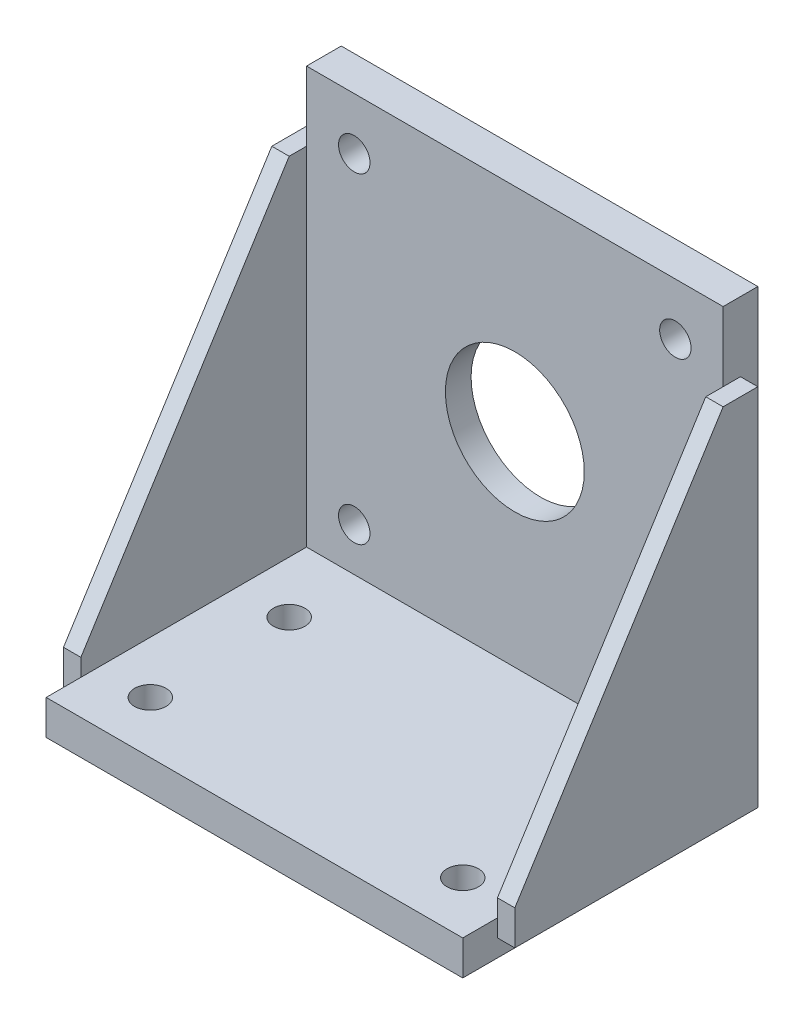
SolidWorks part; units mm, degrees
ref_plane "front" through (0, 0, 0) normal (0, 0, 1) x (1, 0, 0)
ref_plane "top" through (0, 0, 0) normal (0, 1, 0) x (1, 0, 0)
ref_plane "side" through (0, 0, 0) normal (1, 0, 0) x (0, 0, -1)
sketch "Sketch1" plane through (0, 0, 0) normal (0, 0, 1) x (1, 0, 0)
  line L0 (0, 0) -> (0, 77.7875) construction
  line L1 (-58.7375, 0) -> (0, 0) construction
  line L2 (76.2, -74.6125) -> (76.2, 77.7875)
  line L3 (76.2, 77.7875) -> (-76.2, 77.7875)
  line L4 (-76.2, 77.7875) -> (-76.2, -74.6125)
  line L5 (76.2, -74.6125) -> (-76.2, -74.6125)
  line L6 (-58.7375, 58.7375) -> (58.7375, 58.7375) construction
  line L7 (-58.7375, -58.7375) -> (58.7375, -58.7375) construction
  line L8 (-58.7375, -58.7375) -> (-58.7375, 58.7375) construction
  line L9 (58.7375, -58.7375) -> (58.7375, 58.7375) construction
  point P8 (-58.7375, 58.7375)
  point P10 (58.7375, 58.7375)
  point P11 (58.7375, -58.7375)
  dimension "D1" = 77.7875
  dimension "D3" = 117.475
  dimension "D2" = 152.4
  dimension "D5" = 19.05
  dimension "D6" = 152.4
extrude "Base-Extrude" add sketch "Sketch1" along normal blind 12.7
sketch "Sketch2" plane through (76.2, 0, 0) normal (1, 0, 0) x (0, 0, -1)
  line L0 (-6.35, -74.6125) -> (-107.95, -74.6125)
  line L1 (-6.35, -74.6125) -> (-6.35, -87.3125)
  line L2 (-107.95, -87.3125) -> (-6.35, -87.3125)
  line L3 (-107.95, -87.3125) -> (-107.95, -74.6125)
  line L4 (-12.7, -74.6125) -> (0, -74.6125) construction
  dimension "D1" = 101.6
  dimension "D2" = 12.7
extrude "Boss-Extrude1" add sketch "Sketch2" against normal up to vertex
sketch "Sketch3" plane through (76.2, 0, 0) normal (1, 0, 0) x (0, 0, -1)
  line L0 (-6.35, -80.9625) -> (-6.35, 52.3875)
  line L1 (-6.35, 52.3875) -> (-19.05, 52.3875)
  line L2 (-19.05, 52.3875) -> (-95.25, -68.2625)
  line L3 (-95.25, -68.2625) -> (-95.25, -80.9625)
  line L4 (-6.35, -80.9625) -> (-95.25, -80.9625)
  line L5 (-6.35, -74.6125) -> (-6.35, -87.3125) construction
  line L6 (-12.7, 77.7875) -> (0, 77.7875) construction
  line L7 (-107.95, -87.3125) -> (-107.95, -74.6125) construction
  dimension "D1" = 12.7
  dimension "D2" = 12.7
  dimension "D3" = 25.4
  dimension "D4" = 12.7
extrude "Boss-Extrude2" add sketch "Sketch3" along normal blind 6.35
mirror "Mirror1" about plane through (0, 0, 0) normal (1, 0, 0) of "Boss-Extrude2"
sketch "Sketch5" plane through (0, 0, 0) normal (0, 0, -1) x (-1, 0, 0)
  circle A0 centre (0, 0) radius 63.5635
  dimension "D1" = 127.127
extrude "pilot bore" cut sketch "Sketch5" against normal blind 3.302
sketch "Sketch6" plane through (0, 0, 3.302) normal (0, 0, -1) x (-1, 0, 0)
  circle A0 centre (0, 0) radius 25.4
  dimension "D1" = 50.8
extrude "Cut-Extrude3" cut sketch "Sketch6" against normal through all
hole_wizard "1/2-20 Tapped Hole1"
sketch "Sketch8" plane through (0, 0, 12.7) normal (0, 0, 1) x (1, 0, 0)
  point P0 (-58.7375, -58.7375)
sketch "Sketch7" plane through (-58.7375, -58.7375, 12.7) normal (1, 0, 0) x (0, -1, 0)
  line L0 (0, 0) -> (0, 35.2076)
  line L1 (0, 35.2076) -> (5.7544, 31.75)
  line L2 (5.7544, 31.75) -> (5.7544, 0)
  line L5 (5.7544, 0) -> (0, 0)
  line L10 (0, 35.2076) -> (-5.7544, 31.75) construction
  line L11 (0, -6.35) -> (0, 107.95) construction
  dimension "Hole Dia." = 11.5087
  dimension "Hole Depth" = 31.75
  dimension "Drill Angle" = 118
pattern_sketch "Sketch-Pattern1" of "1/2-20 Tapped Hole1"
hole_wizard "1/2-20 Tapped Hole2"
sketch "Sketch10" plane through (0, -74.6125, 0) normal (0, 1, 0) x (-1, 0, 0)
  line L0 (76.2, 107.95) -> (-76.2, 107.95) construction
  line L2 (76.2, 12.7) -> (76.2, 95.25) construction
  point P0 (57.15, 88.9)
  dimension "D1" = 19.05
  dimension "D2" = 19.05
sketch "Sketch9" plane through (-57.15, -74.6125, 88.9) normal (1, 0, 0) x (0, 0, 1)
  line L0 (0, 0) -> (0, 35.2076)
  line L1 (0, 35.2076) -> (5.7544, 31.75)
  line L2 (5.7544, 31.75) -> (5.7544, 0)
  line L5 (5.7544, 0) -> (0, 0)
  line L10 (0, 35.2076) -> (-5.7544, 31.75) construction
  line L11 (0, -6.35) -> (0, 107.95) construction
  dimension "Hole Dia." = 11.5087
  dimension "Hole Depth" = 31.75
  dimension "Drill Angle" = 118
pattern_linear "LPattern1" count 2 spacing 114.3 along (1, 0, 0) count 2 spacing 50.8 along (0, 0, -1) of "1/2-20 Tapped Hole2"
